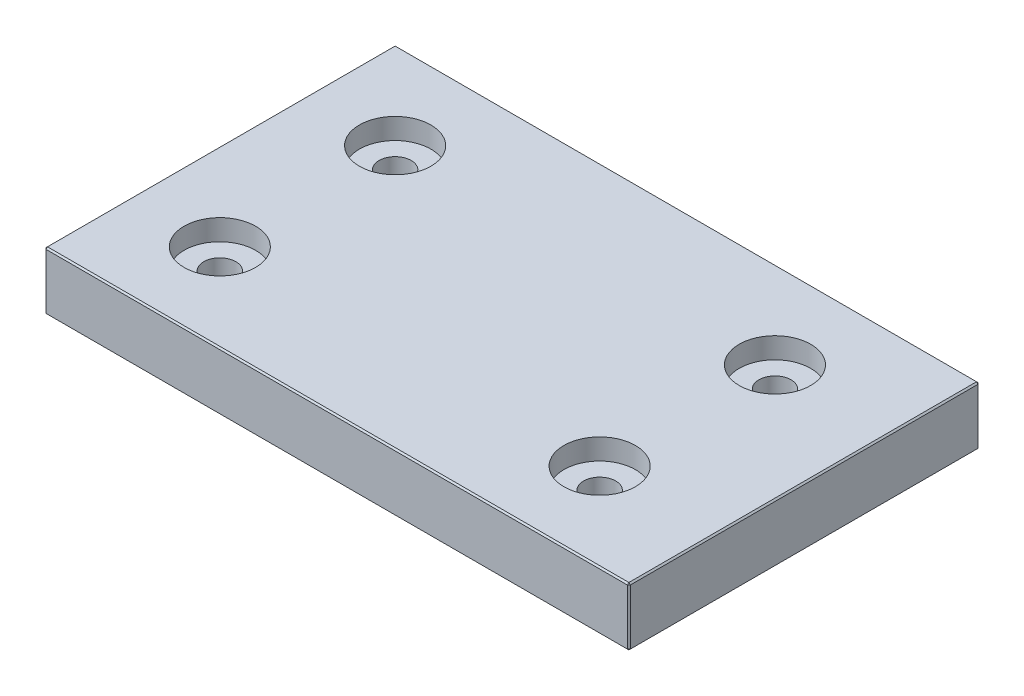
SolidWorks part; units mm, degrees
ref_plane "Front Plane" through (0, 0, 0) normal (0, 0, 1) x (1, 0, 0)
ref_plane "Top Plane" through (0, 0, 0) normal (0, 1, 0) x (1, 0, 0)
ref_plane "Right Plane" through (0, 0, 0) normal (1, 0, 0) x (0, 0, -1)
sketch "Sketch1" plane through (0, 0, 0) normal (0, 1, 0) x (1, 0, 0)
  line L1 (-50, -30) -> (50, -30)
  line L2 (-50, -30) -> (-50, 30)
  line L3 (-50, 30) -> (50, 30)
  line L4 (50, -30) -> (50, 30)
  line L5 (-50, -30) -> (50, 30) construction
  line L6 (-50, 30) -> (50, -30) construction
  point P0 (0, 0)
  dimension "D1" = 100
  dimension "D2" = 60
extrude "Boss-Extrude1" add sketch "Sketch1" along normal blind 10
chamfer "Chamfer1" distance 0.25 angle 45 12 edges at (0, 0, -30) (-50, 5, -30) (-50, 0, 0) (50, 5, -30) (50, 0, 0) (-50, 10, 0) (0, 10, -30) (50, 10, 0) (-50, 5, 30) (0, 10, 30) (50, 5, 30) (0, 0, 30)
hole_wizard "CBORE for M5 Hex Head Bolt1" positions "Sketch2" profile "Sketch3" counterbore size "M5" standard "ANSI Metric"
sketch "Sketch2" plane through (0, 10, 0) normal (0, 1, 0) x (-1, 0, 0)
  line L0 (-49.75, 30) -> (49.75, 30) construction
  line L1 (50, 29.75) -> (50, -29.75) construction
  point P0 (35, 15)
  dimension "D1" = 15
  dimension "D2" = 15
sketch "Sketch3" plane through (-35, 10, 15) normal (1, 0, 0) x (0, 0, 1)
  line L0 (0, 0) -> (0, 10)
  line L1 (0, 10) -> (2.75, 10)
  line L3 (2.75, 10) -> (2.75, 3.58)
  line L4 (2.75, 3.58) -> (6.12, 3.58)
  line L5 (6.12, 3.58) -> (6.12, 0)
  line L7 (6.12, 0) -> (0, 0)
  line L11 (0, -6.35) -> (0, 107.95) construction
  dimension "Thru Hole Dia." = 5.5
  dimension "Thru Hole Depth" = 10
  dimension "C'Bore Dia." = 12.24
  dimension "C'Bore Depth" = 3.58
pattern_linear "LPattern1" count 2 spacing 65 along (1, 0, 0) count 2 spacing 30 along (0, 0, -1) of "CBORE for M5 Hex Head Bolt1"
